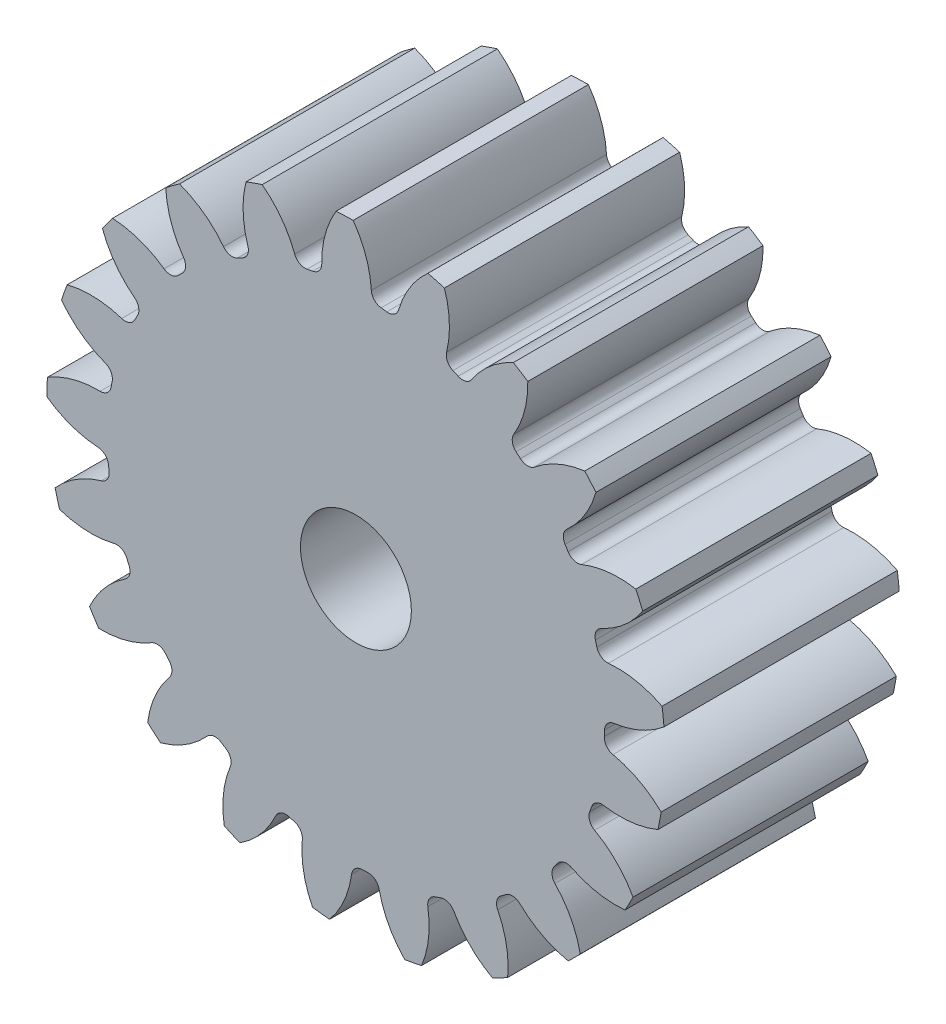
SolidWorks part; units mm, degrees
ref_plane "Front" through (0, 0, 0) normal (0, 0, 1) x (1, 0, 0)
ref_plane "Top" through (0, 0, 0) normal (0, 1, 0) x (1, 0, 0)
ref_plane "Right" through (0, 0, 0) normal (1, 0, 0) x (0, 0, -1)
sketch "Sketch3" plane through (0, 0, 0) normal (0, 0, 1) x (1, 0, 0)
  circle A0 centre (0, 0) radius 116.84
  dimension "od" = 233.68
extrude "gearBody" add sketch "Sketch3" along normal blind 88.9
sketch "Sketch2" plane through (0, 0, 0) normal (0, 0, 1) x (1, 0, 0)
  line L0 (0, 0) -> (92.6156, 38.3626) construction
  line L1 (115.725, -19.013) -> (0, 0) construction
  line L2 (0, 0) -> (36.3143, 0) construction
  line L3 (106.6095, 3.8767) -> (106.001, -12.0171) construction
  line L5 (106.3053, -4.0702) -> (0, 0) construction
  line L7 (0, 0) -> (100.2464, 0) construction
  arc A0 (100.2278, 1.9323) -> (99.7866, -9.5905) centre (0, 0) ccw construction
  arc A1 (116.4314, 9.7633) -> (115.344, -18.6375) centre (0, 0) ccw construction
  arc A2 (106.6095, 3.8767) -> (106.001, -12.0171) centre (0, 0) ccw construction
  arc A3 (93.8637, -4.6746) -> (93.9463, -2.5162) centre (0, 0) ccw
  arc A4 (115.725, -19.013) -> (97.1354, -8.9254) centre (89.4111, -45.3321) ccw
  arc A5 (115.725, -19.013) -> (116.84, 10.1086) centre (0, 0) ccw
  arc A6 (116.84, 10.1086) -> (97.5335, 1.4719) centre (92.6156, 38.3626) cw
  arc A7 (93.9463, -2.5162) -> (97.5335, 1.4719) centre (98.0799, -2.627) cw
  arc A8 (97.1354, -8.9254) -> (93.8637, -4.6746) centre (97.9937, -4.8803) cw
  point P6 (116.84, 10.1086)
  point P22 (115.725, -19.013)
  dimension "baseDia" = 200.4928
  dimension "od" = 233.68
  dimension "pd" = 213.36
  dimension "rd" = 187.96
  dimension "rFillet" = 4.1351
  dimension "pointX" = 116.84
  dimension "pointY" = 10.1086
  dimension "CTT" = 15.8937
  dimension "flankCenterAngle" = 22.5
extrude "toothCut" cut sketch "Sketch2" along normal through all
pattern_circular "CirPattern1" count 21 over 360 about axis through (0, 0, 0) along (0, 0, 1) of "toothCut"
sketch "hub1Dia" plane through (0, 0, 0) normal (0, 0, -1) x (-1, 0, 0)
  circle A0 centre (0, 0) radius 12.7
  dimension "hub1Dia" = 25.4
sketch "hub2Dia" plane through (0, 0, 88.9) normal (0, 0, 1) x (1, 0, 0)
  circle A0 centre (0, 0) radius 12.7
  dimension "hub2dia" = 25.4
sketch "boreDia" plane through (0, 0, 0) normal (0, 0, 1) x (1, 0, 0)
  circle A0 centre (0, 0) radius 20.955
  dimension "boreDia" = 41.91
extrude "bore" cut sketch "boreDia" against normal mid plane 25400
